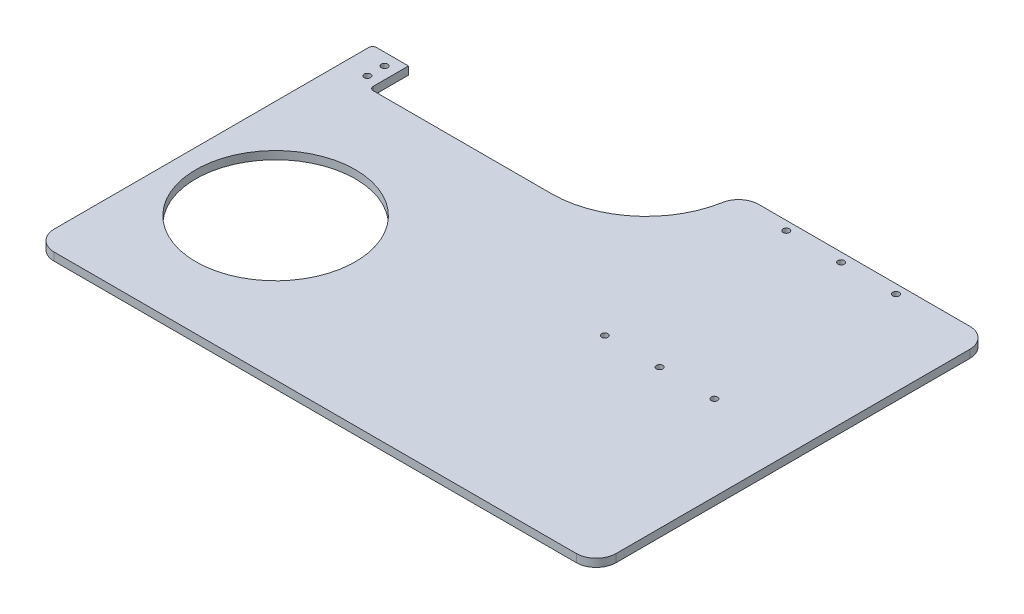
SolidWorks part; units mm, degrees
ref_plane "Plano frontal" through (0, 0, 0) normal (0, 0, 1) x (1, 0, 0)
ref_plane "Plano superior" through (0, 0, 0) normal (0, 1, 0) x (1, 0, 0)
ref_plane "Plano direito" through (0, 0, 0) normal (1, 0, 0) x (0, 0, -1)
sketch "Esboço1" plane through (0, 0, 0) normal (0, 1, 0) x (1, 0, 0)
  line L1 (-75, -100) -> (325, -100)
  line L2 (-75, -100) -> (-75, 150)
  line L3 (-75, 150) -> (325, 150)
  line L4 (325, -100) -> (325, 150)
  point P0 (0, 0)
  dimension "D3" = 100
  dimension "D1" = 250
  dimension "D2" = 400
  dimension "D4" = 75
extrude "Ressalto-extrusão1" add sketch "Esboço1" along normal blind 4
sketch "Esboço2" plane through (0, 4, 0) normal (0, 1, 0) x (1, 0, 0)
  line L1 (111.65, 170.2584) -> (111.65, -14.347) construction
  line L2 (217.9154, 140) -> (217.9154, 40) construction
  line L3 (217.9154, 40) -> (107.9154, 40) construction
  line L5 (0, 0) -> (0, 90) construction
  line L6 (0, 44.5) -> (271.1635, 44.5) construction
  line L7 (0, 90) -> (431.5449, 90) construction
  line L8 (0, 135.5) -> (271.1635, 135.5) construction
  line L9 (0, 140) -> (271.1635, 140) construction
  line L10 (217.9154, 40) -> (217.9154, 140) construction
  line L11 (217.9154, 40) -> (107.9154, 40) construction
  line L12 (107.9154, 40) -> (107.9154, 140) construction
  point P19 (0, 0)
  point P24 (107.9154, 140)
  dimension "D1" = 90
  dimension "D2" = 45.5
  dimension "D3" = 4.5
  dimension "D4" = 45.5
  dimension "D5" = 111.65
sketch "Esboço3" plane through (0, 4, 0) normal (0, 1, 0) x (1, 0, 0)
  line L16 (30.8962, 81) -> (30.8962, 99) construction
  line L17 (30.8962, 81) -> (30.8962, 99) construction
  line L18 (30.8962, 99) -> (-48.5185, 99) construction
  line L19 (30.8962, 81) -> (-41.4165, 81) construction
sketch "Esboço4" plane through (0, 4, 0) normal (0, 1, 0) x (1, 0, 0)
  line L1 (-75, 150) -> (325, 150)
  line L2 (-75, 150) -> (-75, -100)
  line L3 (-75, -100) -> (325, -100)
  line L4 (325, 150) -> (325, -100)
  line L5 (-30.8038, 112.3206) -> (-30.8038, 94.7051)
  line L6 (-28.8038, 92.7051) -> (60.6205, 92.7051)
  line L8 (117.036, 140) -> (222.9154, 140)
  line L9 (232.9154, 130) -> (232.9154, -47.2949)
  line L10 (222.9154, -57.2949) -> (-38.8038, -57.2949)
  line L11 (-48.8038, -47.2949) -> (-48.8038, 110.3206)
  line L12 (0, 140) -> (271.1635, 140) construction
  line L13 (217.9154, 140) -> (217.9154, 40) construction
  line L14 (107.9154, 40) -> (107.9154, 140) construction
  line L18 (-46.8038, 112.3206) -> (-30.8038, 112.3206)
  line L23 (35.5962, 92.7051) -> (35.5962, 87.2949) construction
  line L24 (35.5962, 92.7051) -> (35.5962, 87.2949) construction
  line L25 (-33.8038, 109.3206) -> (-33.8038, 82.5) construction
  line L26 (-39.8038, 109.3206) -> (-33.8038, 109.3206) construction
  line L27 (-39.8038, 109.3206) -> (-33.8038, 109.3206) construction
  arc A0 (60.6205, 92.7051) -> (107.1894, 131.7454) centre (60.6205, 140) ccw
  arc A1 (-30.8038, 94.7051) -> (-28.8038, 92.7051) centre (-28.8038, 94.7051) ccw
  arc A2 (107.1894, 131.7454) -> (117.036, 140) centre (117.036, 130) cw
  arc A3 (222.9154, 140) -> (232.9154, 130) centre (222.9154, 130) cw
  arc A4 (232.9154, -47.2949) -> (222.9154, -57.2949) centre (222.9154, -47.2949) cw
  arc A5 (-38.8038, -57.2949) -> (-48.8038, -47.2949) centre (-38.8038, -47.2949) cw
  arc A6 (-46.8038, 112.3206) -> (-48.8038, 110.3206) centre (-46.8038, 110.3206) ccw
  point P35 (107.9154, 140)
  point P46 (-48.8038, 112.3206)
  dimension "D2" = 150
  dimension "D4" = 2
  dimension "D5" = 10
  dimension "D6" = 2
  dimension "D1" = 15
  dimension "D3" = 18
  dimension "D7" = 3
  dimension "D8" = 3
extrude "Corte-extrusão2" cut sketch "Esboço4" against normal blind 4 contours L2 L1 L4 L3 | L11 A6 L18 L5 A1 L6 A0 A2 L8 A3 L9 A4 L10 A5
sketch "Esboço5" plane through (0, 4, 0) normal (0, 1, 0) x (1, 0, 0)
  line L4 (30.8962, 99) -> (-48.5185, 99) construction
  line L5 (0.8962, 14) -> (0.8962, 109.7565) construction
  line L6 (35.5962, 92.7) -> (-33.8038, 92.7) construction
  line L7 (35.5962, 92.7) -> (-33.8038, 92.7) construction
  circle A0 centre (-36.8038, 106.3206) radius 1.6
  circle A1 centre (-36.8038, 97.7206) radius 1.6
  circle A2 centre (135.4154, 135.5) radius 1.6
  circle A3 centre (162.9154, 135.5) radius 1.6
  circle A4 centre (190.4154, 135.5) radius 1.6
  circle A5 centre (190.4154, 44.5) radius 1.6
  circle A6 centre (162.9154, 44.5) radius 1.6
  circle A7 centre (135.4154, 44.5) radius 1.6
  circle A9 centre (0.8962, 14) radius 40
  circle A11 centre (-36.8038, 106.3206) radius 1.3 construction
  circle A12 centre (-36.8038, 97.7206) radius 1.3 construction
  circle A13 centre (135.4154, 44.5) radius 1.6 construction
  circle A14 centre (162.9154, 44.5) radius 1.6 construction
  circle A15 centre (190.4154, 44.5) radius 1.6 construction
  circle A16 centre (135.4154, 135.5) radius 1.6 construction
  circle A17 centre (162.9154, 135.5) radius 1.6 construction
  circle A18 centre (190.4154, 135.5) radius 1.6 construction
  point P29 (0.8962, 92.7)
  dimension "D1" = 3.2
  dimension "D2" = 80
  dimension "D3" = 85
extrude "Corte-extrusão3" cut sketch "Esboço5" against normal up to next
